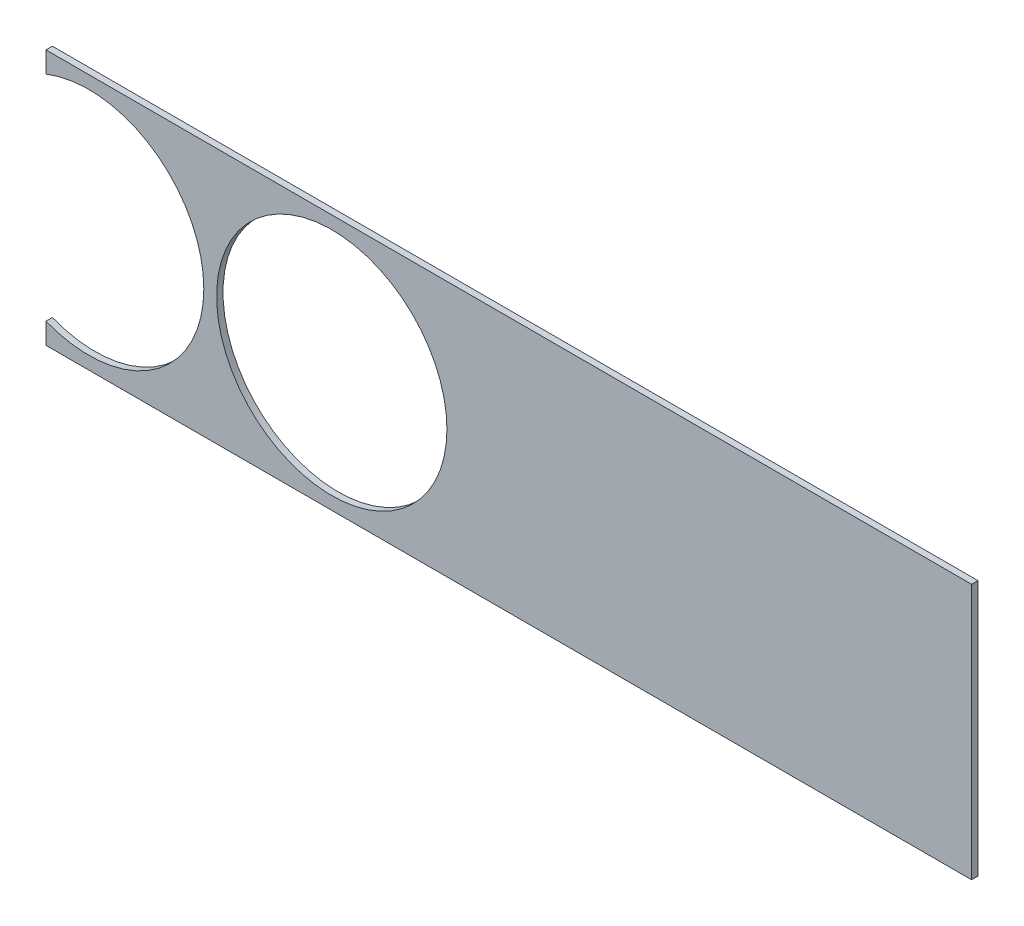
SolidWorks part; units mm, degrees
ref_plane "Plan XY" through (0, 0, 0) normal (0, 0, 1) x (1, 0, 0)
ref_plane "Plan XZ" through (0, 0, 0) normal (0, 1, 0) x (1, 0, 0)
ref_plane "Plan YZ" through (0, 0, 0) normal (1, 0, 0) x (0, 0, -1)
sketch "Esquisse1" plane through (0, 0, 0) normal (0, 0, 1) x (1, 0, 0)
  line L0 (-89.7594, 0) -> (192.4771, 0) construction
  line L1 (-67, 30) -> (150, 30)
  line L2 (-67, 30) -> (-67, 25.0799)
  line L3 (-67, -30) -> (150, -30)
  line L4 (150, 30) -> (150, -30)
  line L5 (-67, -25.0799) -> (-67, -30)
  circle A0 centre (0, 0) radius 27
  arc A1 (-67, -25.0799) -> (-67, 25.0799) centre (-57, 0) ccw
  dimension "D1" = 54
  dimension "D2" = 57
  dimension "D3" = 60
  dimension "D4" = 67
  dimension "D5" = 150
extrude "Boss.-Extru.1" add sketch "Esquisse1" along normal blind 1.5
